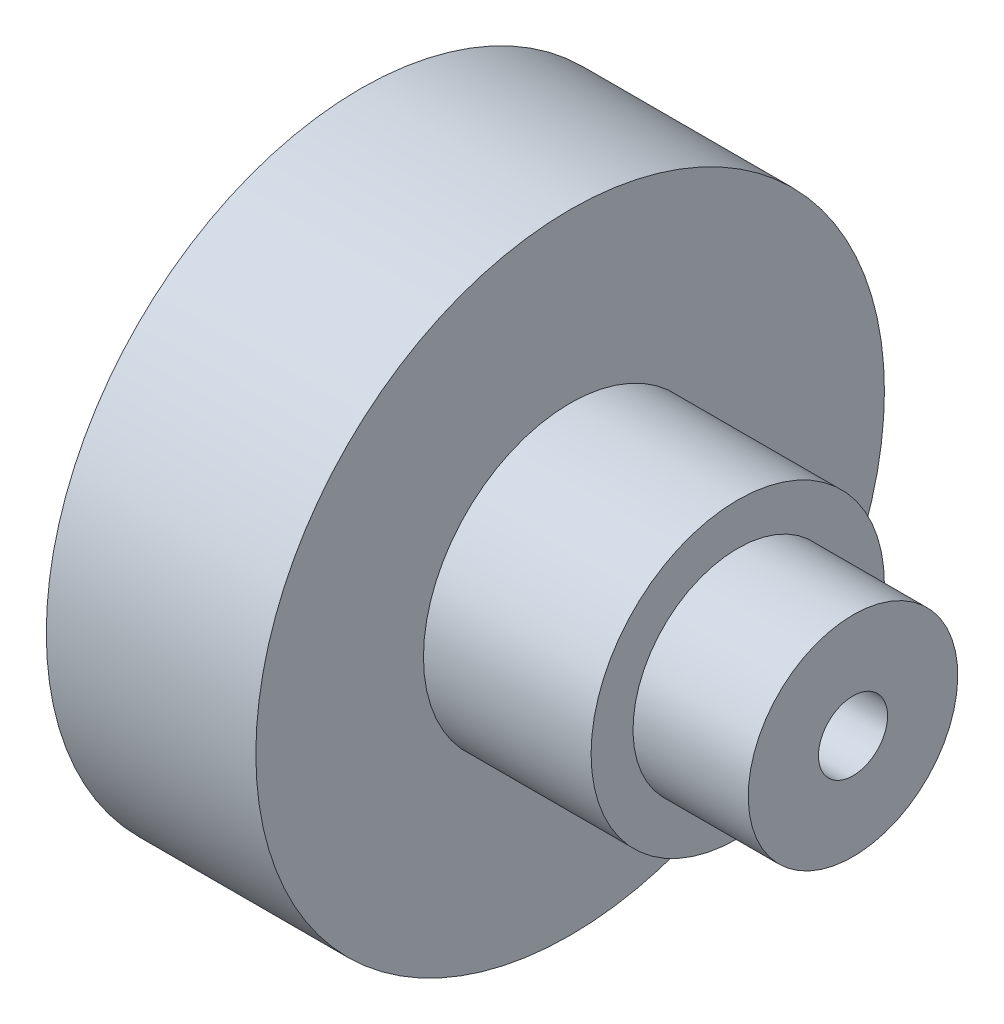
SolidWorks part; units mm, degrees
ref_plane "Front Plane" through (0, 0, 0) normal (0, 0, 1) x (1, 0, 0)
ref_plane "Top Plane" through (0, 0, 0) normal (0, 1, 0) x (1, 0, 0)
ref_plane "Right Plane" through (0, 0, 0) normal (1, 0, 0) x (0, 0, -1)
sketch "Sketch1" plane through (0, 0, 0) normal (0, 0, 1) x (1, 0, 0)
  line L0 (0, 0) -> (0, 15)
  line L1 (0, 15) -> (10, 15)
  line L2 (10, 15) -> (10, 7)
  line L3 (10, 7) -> (18, 7)
  line L4 (18, 7) -> (18, 5)
  line L5 (18, 5) -> (23.5, 5)
  line L6 (23.5, 5) -> (23.5, 0)
  line L7 (23.5, 0) -> (0, 0)
  dimension "D1" = 5
  dimension "D2" = 7
  dimension "D3" = 15
  dimension "D4" = 10
  dimension "D5" = 18
  dimension "D6" = 23.5
revolve "Revolve1" add sketch "Sketch1" angle 360 about L7
sketch "Sketch4" plane through (23.5, 0, 0) normal (1, 0, 0) x (0, 0, -1)
  point P0 (0, 0)
hole_wizard "M4 Tapped Hole1" positions "3DSketch2" profile "Sketch6" tap size "M4" standard "ISO"
sketch3d "3DSketch2"
  point P0 (23.5, 0, 0)
sketch "Sketch6" plane through (23.5, 0, 0) normal (0, 1, 0) x (0, 0, -1)
  line L0 (0, 0) -> (0, 23.4914)
  line L1 (0, 23.4914) -> (1.65, 22.5)
  line L2 (1.65, 22.5) -> (1.65, 0)
  line L5 (1.65, 0) -> (0, 0)
  line L10 (0, 23.4914) -> (-1.65, 22.5) construction
  line L11 (0, -6.35) -> (0, 107.95) construction
  dimension "Tap Drill Dia." = 3.3
  dimension "Tap Drill Depth" = 22.5
  dimension "Drill Angle" = 118
sketch "Sketch7" plane through (0, 0, 0) normal (-1, 0, 0) x (0, 0, 1)
  circle A0 centre (0, 0) radius 1.65
  dimension "D1" = 3.3
extrude "Extrude1" cut sketch "Sketch7" against normal blind 5
